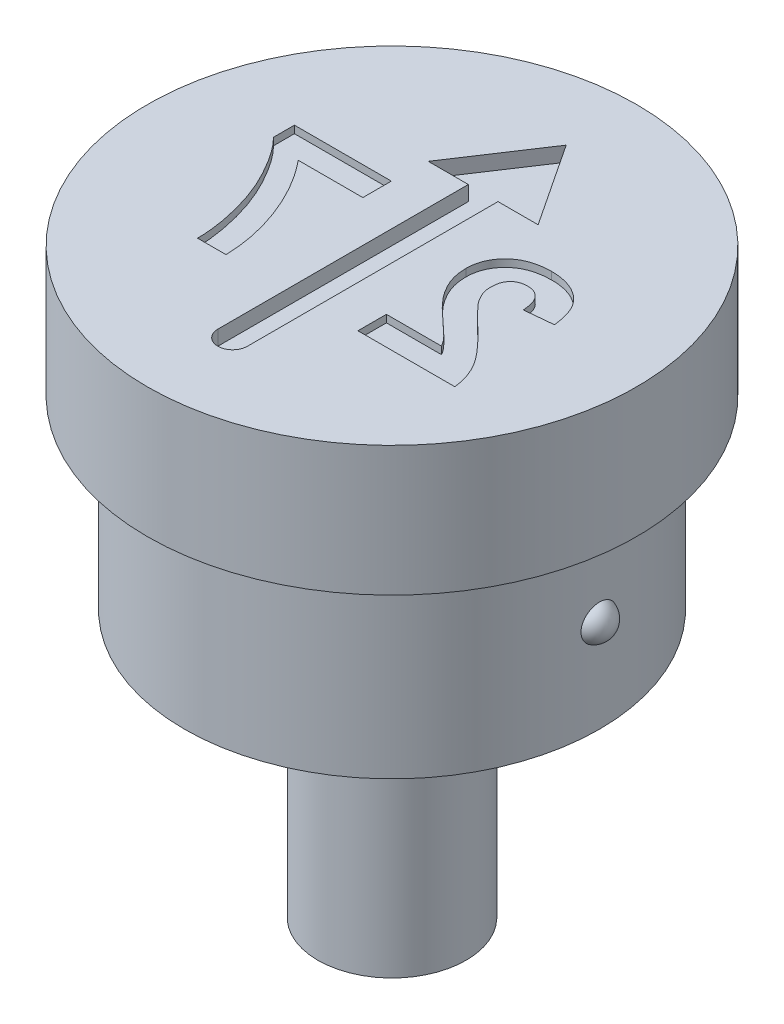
SolidWorks part; units mm, degrees
ref_plane "Front Plane" through (0, 0, 0) normal (0, 0, 1) x (1, 0, 0)
ref_plane "Top Plane" through (0, 0, 0) normal (0, 1, 0) x (1, 0, 0)
ref_plane "Right Plane" through (0, 0, 0) normal (1, 0, 0) x (0, 0, -1)
sketch "Sketch1" plane through (0, 0, 0) normal (0, 0, 1) x (1, 0, 0)
  line L0 (0, 0) -> (0, -15.7) construction
  line L1 (0, -7.26) -> (0, 7.26) construction
  line L2 (0, 0) -> (-6.6, 0)
  line L3 (-6.6, 0) -> (-6.6, -3.5)
  line L4 (-6.6, -3.5) -> (-5.6, -3.5)
  line L5 (-5.6, -3.5) -> (-5.6, -8.5)
  line L6 (-5.6, -8.5) -> (-2, -8.5)
  line L7 (-2, -8.5) -> (-2, -15.7)
  line L8 (-2, -15.7) -> (0, -15.7)
  line L9 (0, -15.7) -> (0, 0)
  dimension "D1" = 13.2
  dimension "D2" = 15.7
  dimension "D3" = 3.5
  dimension "D4" = 8.5
  dimension "D5" = 11.2
  dimension "D6" = 4
revolve "Revolve1" add sketch "Sketch1" angle 360 about L0
sketch "Sketch3" plane through (0, 0, 0) normal (0, 1, 0) x (1, 0, 0)
  line L0 (0, 4.7) -> (-1.4826, 2.46)
  line L1 (-1.4826, 2.46) -> (-0.4, 2.46)
  line L2 (-0.4, 2.46) -> (-0.4, -4.3)
  line L3 (0.4, -4.3) -> (0.4, 2.46)
  line L4 (0.4, 2.46) -> (1.4826, 2.46)
  line L5 (1.4826, 2.46) -> (0, 4.7)
  line L6 (0, 4.7) -> (0, -4.7) construction
  arc A0 (-0.4, -4.3) -> (0.4, -4.3) centre (0, -4.3) ccw
  dimension "D3" = 0.4
  dimension "D1" = 2.24
  dimension "D2" = 67
  dimension "D4" = 9
extrude "Cut-Extrude1" cut sketch "Sketch3" against normal blind 0.4
sketch "Sketch4" plane through (0, 0, 0) normal (0, 1, 0) x (1, 0, 0)
  text T0 "27" font "Arial" height 4
extrude "Cut-Extrude2" cut sketch "Sketch4" against normal blind 0.2
sketch "Sketch5" plane through (0, 0, 0) normal (0, 0, 1) x (1, 0, 0)
  line L2 (5.4373, -5.5) -> (5.4373, -6.5)
  line L3 (5.4373, -5.5) -> (5.4373, -6.5) construction
  line L4 (-5.6, -6) -> (5.4373, -6) construction
  line L5 (-5.6, -3.5) -> (-5.6, -8.5) construction
  arc A1 (5.4373, -6.5) -> (5.4373, -5.5) centre (5.4373, -6) ccw
  dimension "D1" = 0.5
revolve "Revolve2" add sketch "Sketch5" angle 360 about L2
